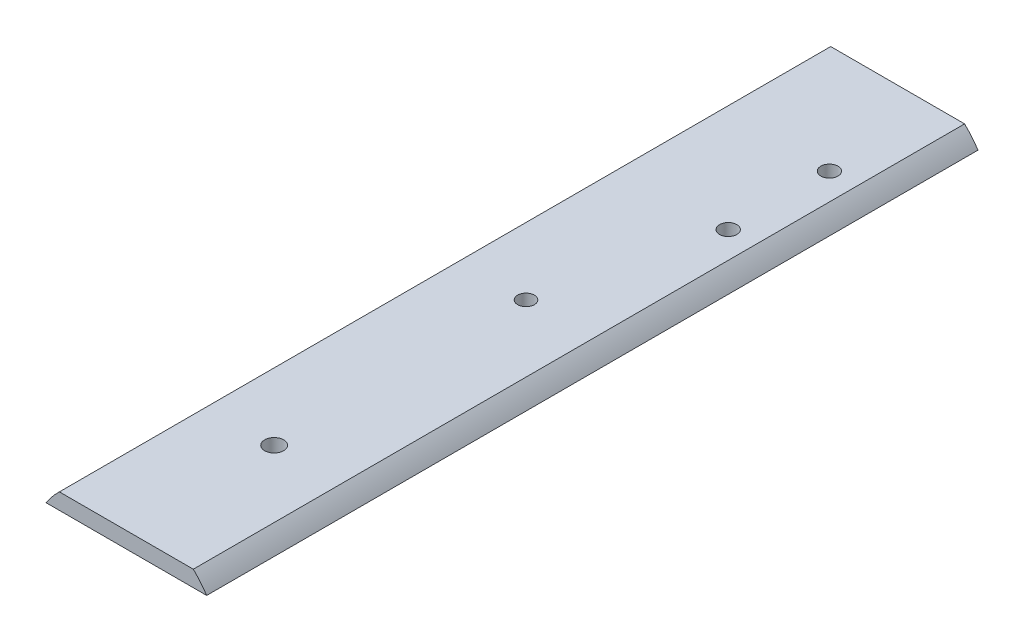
SolidWorks part; units mm, degrees
ref_plane "Front Plane" through (0, 0, 0) normal (0, 0, 1) x (1, 0, 0)
ref_plane "Top Plane" through (0, 0, 0) normal (0, 1, 0) x (1, 0, 0)
ref_plane "Right Plane" through (0, 0, 0) normal (1, 0, 0) x (0, 0, -1)
inserted part "Assem2<1>@Assem1/Extended Part 1<1>@Assem2"
